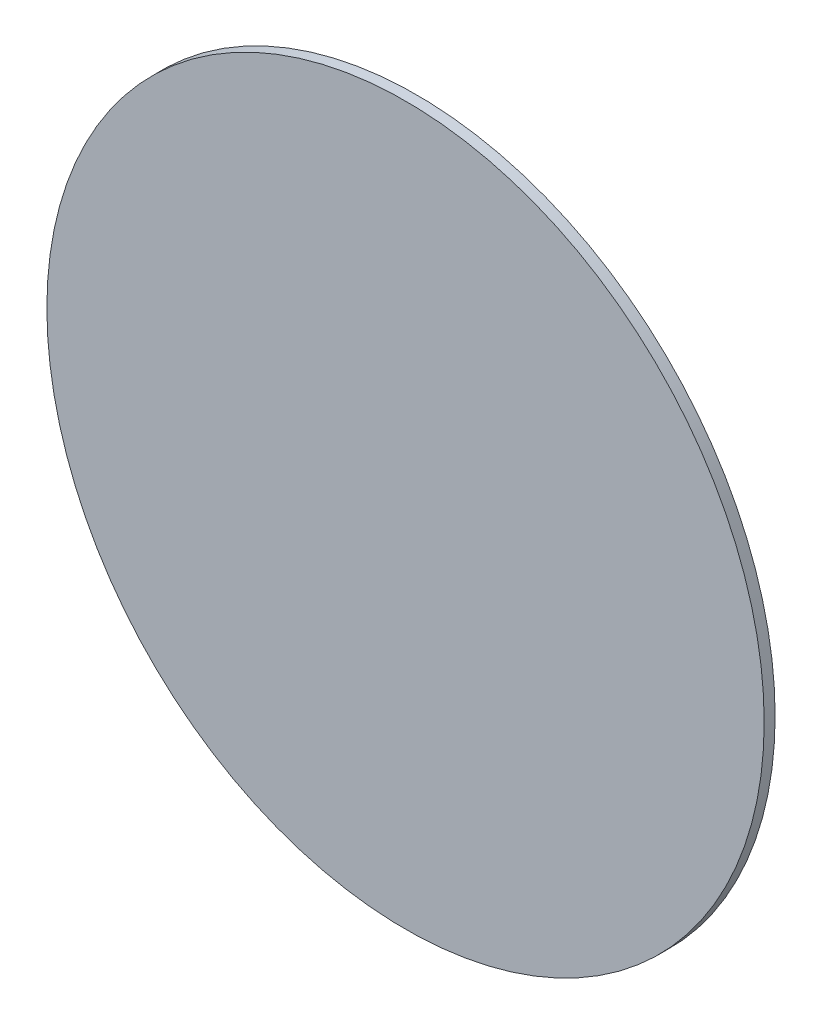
SolidWorks part; units mm, degrees
ref_plane "Front Plane" through (0, 0, 0) normal (0, 0, 1) x (1, 0, 0)
ref_plane "Top Plane" through (0, 0, 0) normal (0, 1, 0) x (1, 0, 0)
ref_plane "Right Plane" through (0, 0, 0) normal (1, 0, 0) x (0, 0, -1)
sketch "Sketch1" plane through (0, 0, 0) normal (0, 0, 1) x (1, 0, 0)
  circle A0 centre (0, 0) radius 4
  dimension "D1" = 8
extrude "Extrude1" add sketch "Sketch1" along normal blind 0.1219
